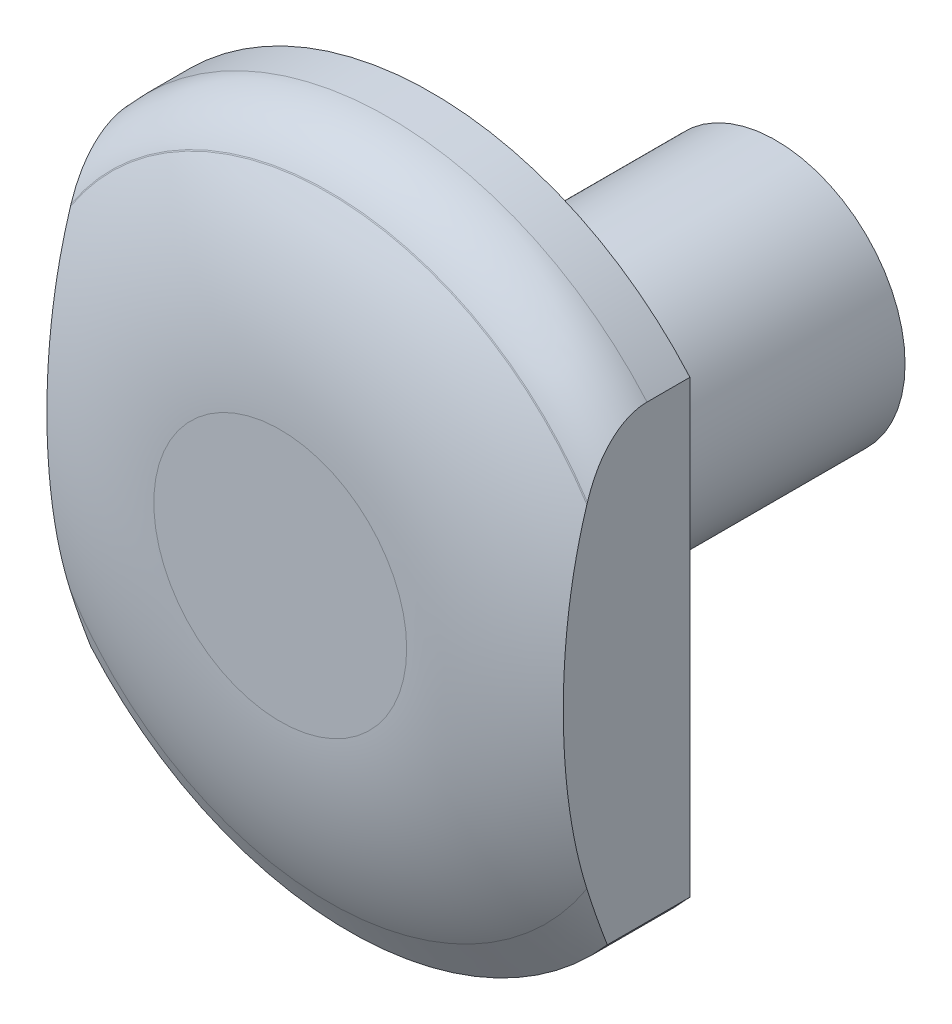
SolidWorks part; units mm, degrees
ref_plane "Спереди" through (0, 0, 0) normal (0, 0, 1) x (1, 0, 0)
ref_plane "Сверху" through (0, 0, 0) normal (0, 1, 0) x (1, 0, 0)
ref_plane "Справа" through (0, 0, 0) normal (1, 0, 0) x (0, 0, -1)
other "Configuration Table"
sketch "Эскиз1" plane through (0, 0, 0) normal (0, 0, 1) x (1, 0, 0)
  circle A0 centre (0, 0) radius 7.5
  dimension "D1" = 15
extrude "Бобышка-Вытянуть1" add sketch "Эскиз1" along normal blind 20
sketch "Эскиз2" plane through (0, 0, 20) normal (0, 0, 1) x (1, 0, 0)
  line L0 (0, 23.6336) -> (0, -23.1902) construction
  line L1 (-15, 13.0771) -> (-15, -13.0771)
  line L2 (15, 13.0771) -> (15, -13.0771)
  arc A0 (-15, -13.0771) -> (15, -13.0771) centre (0, 0) ccw
  arc A1 (15, 13.0771) -> (-15, 13.0771) centre (0, 0) ccw
  dimension "D1" = 39.8
  dimension "D2" = 30
extrude "Бобышка-Вытянуть6" add sketch "Эскиз2" along normal blind 2.8
sketch "Эскиз9" plane through (0, 0, 22.8) normal (0, 0, 1) x (1, 0, 0)
  line L0 (-15, 13.0771) -> (-15, -13.0771)
  line L1 (15, 13.0771) -> (15, -13.0771)
  line L2 (15, -13.0771) -> (15, 13.0771) construction
  arc A0 (-15, -13.0771) -> (15, -13.0771) centre (0, 0) ccw
  arc A1 (15, 13.0771) -> (-15, 13.0771) centre (0, 0) ccw
  dimension "D2" = 30
extrude "Бобышка-Вытянуть7" add sketch "Эскиз9" along normal blind 6
chamfer "Фаска2" distance 4 angle 60 1 edges at (0, -19.9, 28.8)
fillet "Скругление4" radius 4 1 edges at (0, 19.9, 24.8)
fillet "Скругление5" radius 21 1 edges at (12.9718, 0, 28.8)
sketch "Эскиз10" plane through (0, 0, 28.8) normal (0, 0, 1) x (1, 0, 0)
  circle A0 centre (0, 0) radius 6
  dimension "D1" = 12
extrude "Вырез-Вытянуть1" cut sketch "Эскиз10" against normal blind 2.5
sketch "Эскиз11" plane through (0, 0, 26.3) normal (0, 0, 1) x (1, 0, 0)
  circle A0 centre (0, 0) radius 3.4
  dimension "D1" = 6.8
extrude "Вырез-Вытянуть2" cut sketch "Эскиз11" against normal through all
sketch "Эскиз12" plane through (0, 0, 0) normal (0, 0, -1) x (-1, 0, 0)
  circle A0 centre (0, 0) radius 4.925
  dimension "D1" = 9.85
extrude "Вырез-Вытянуть4" cut sketch "Эскиз12" against normal blind 13.98
chamfer "Фаска5" distance 1 angle 45 2 edges at (-3.4, 0, 13.98) (3.4, 0, 26.3)
thread "Резьба2" pitch 1.25 start angle 0, offset 2, length 13, pitch 1.25, diameter 6.8
ref_plane "Плоскость2" through (-3.4, 0, 27.3) normal (0, -1, 0) x (-1, 0, 0)
sketch "Профиль резьбы2" plane through (-3.4, 0, 27.3) normal (0, -1, 0) x (-1, 0, 0)
  line L0 (0, 0) -> (0, 1.25) construction
  line L1 (0, 0) -> (0.6766, 0.3906)
  line L2 (0.6766, 0.3906) -> (0.6766, 0.5469)
  line L3 (0.6766, 0.5469) -> (0, 0.9375)
  line L4 (0.6766, 0.4687) -> (0, 0.4687) construction
  line L11 (0, 0) -> (0, 0.9375)
  point P2 (0, 0)
  dimension "Pitch" = 1.25
  dimension "Profile_Angle" = 60
  dimension "Profile_Land" = 0.1562
  dimension "Profile_Height" = 0.6766
sketch "Эскиз14" plane through (0, 0, 0) normal (0, 0, 1) x (1, 0, 0)
sketch "Эскиз16" plane through (0, 0, 28.8) normal (0, 0, 1) x (1, 0, 0)
  circle A0 centre (0, 0) radius 6
extrude "Бобышка-Вытянуть9" add sketch "Эскиз16" against normal blind 2.6
